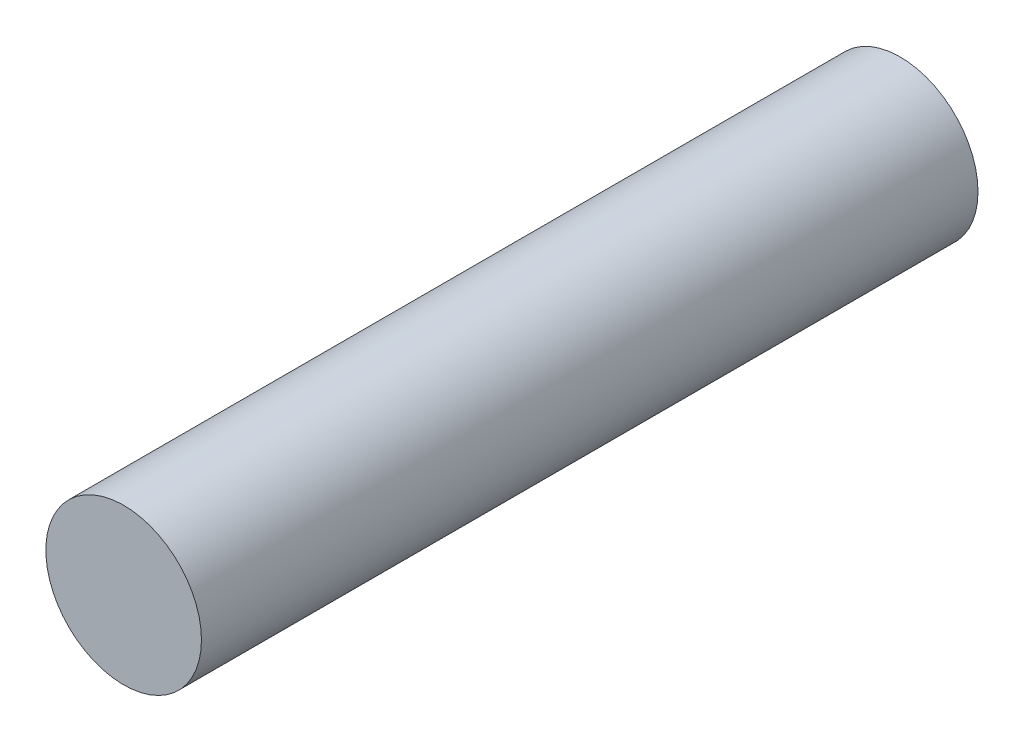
SolidWorks part; units mm, degrees
ref_plane "Front" through (0, 0, 0) normal (0, 0, 1) x (1, 0, 0)
ref_plane "Top" through (0, 0, 0) normal (0, 1, 0) x (1, 0, 0)
ref_plane "Right" through (0, 0, 0) normal (1, 0, 0) x (0, 0, -1)
sketch "Sketch1" plane through (0, 0, 0) normal (0, 0, 1) x (1, 0, 0)
  circle A1 centre (0, 0) radius 15
extrude "Extrude1" add sketch "Sketch1" against normal blind 149.7177
